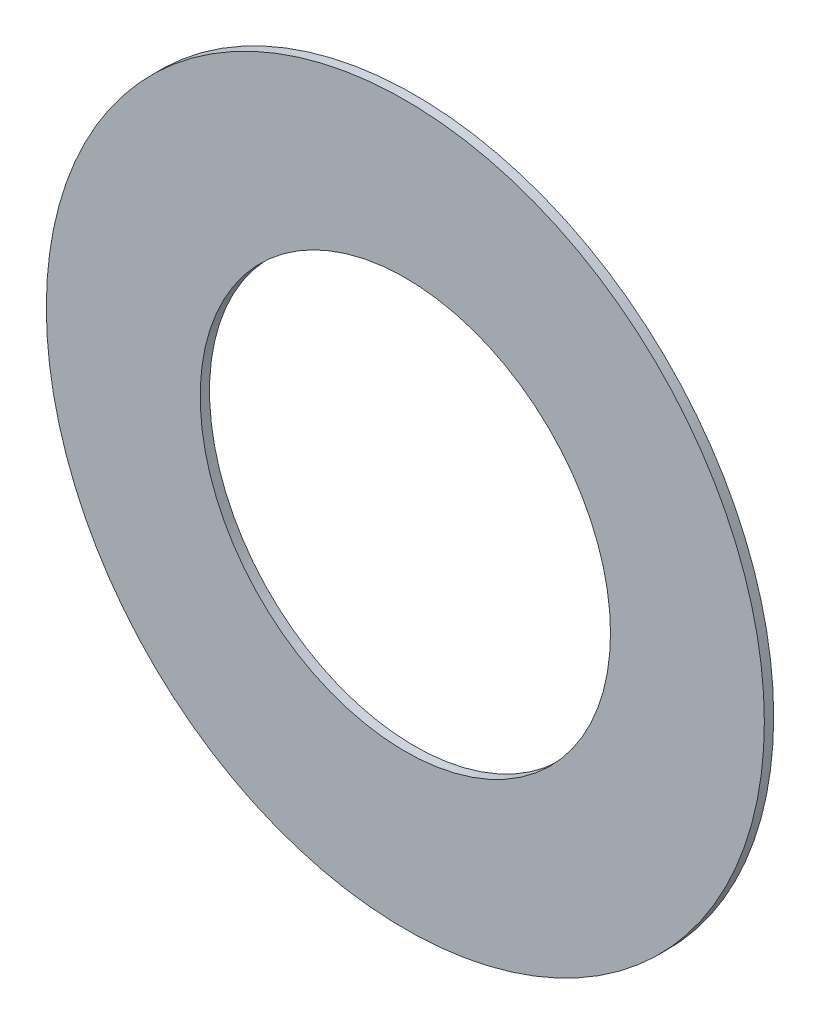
SolidWorks part; units mm, degrees
ref_plane "Plan de face" through (0, 0, 0) normal (0, 0, 1) x (1, 0, 0)
ref_plane "Plan de dessus" through (0, 0, 0) normal (0, 1, 0) x (1, 0, 0)
ref_plane "Plan de droite" through (0, 0, 0) normal (1, 0, 0) x (0, 0, -1)
sketch "Esquisse1" plane through (0, 0, 0) normal (0, 0, 1) x (1, 0, 0)
  circle A0 centre (0, 0) radius 192.5
  circle A1 centre (0, 0) radius 110
  dimension "D1" = 385
  dimension "D2" = 220
extrude "Extrusion1" add sketch "Esquisse1" along normal blind 5
